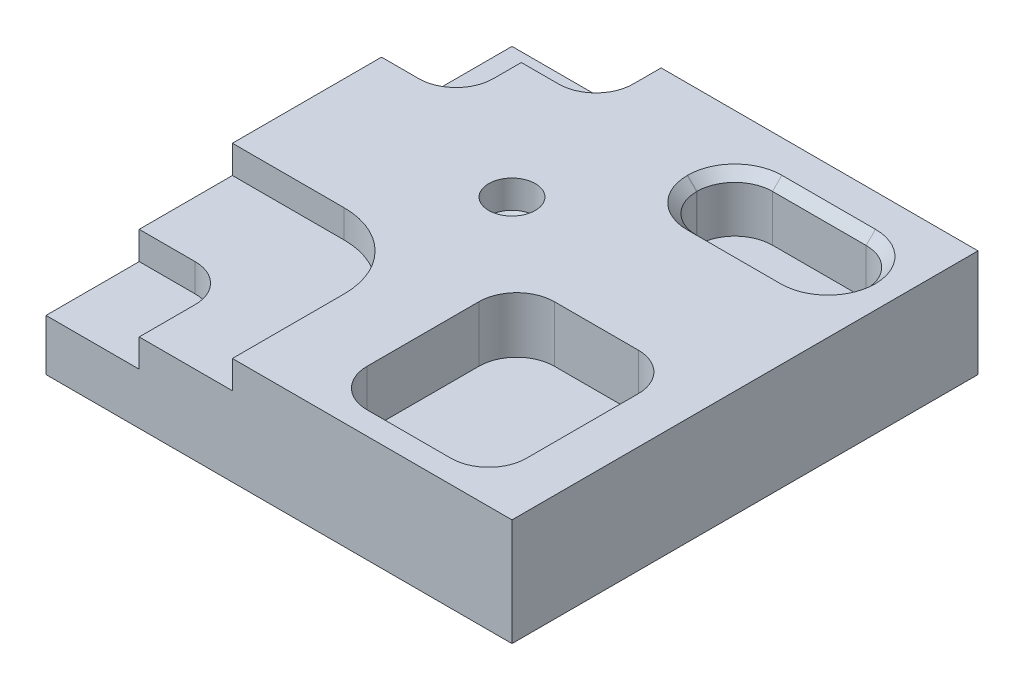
SolidWorks part; units mm, degrees
ref_plane "Front Plane" through (0, 0, 0) normal (0, 0, 1) x (1, 0, 0)
ref_plane "Top Plane" through (0, 0, 0) normal (0, 1, 0) x (1, 0, 0)
ref_plane "Right Plane" through (0, 0, 0) normal (1, 0, 0) x (0, 0, -1)
sketch "Sketch1" plane through (0, 0, 0) normal (0, 1, 0) x (1, 0, 0)
  line L1 (25, -25) -> (-25, -25)
  line L2 (25, -25) -> (25, 25)
  line L3 (25, 25) -> (-25, 25)
  line L4 (-25, -25) -> (-25, 25)
  line L5 (25, -25) -> (-25, 25) construction
  line L6 (25, 25) -> (-25, -25) construction
  point P0 (0, 0)
  dimension "D1" = 50
  dimension "D2" = 50
extrude "Boss-Extrude1" add sketch "Sketch1" along normal blind 11.5
sketch "Sketch2" plane through (0, 11.5, 0) normal (0, 1, 0) x (1, 0, 0)
  line L3 (-25, -15) -> (-15, -15)
  line L4 (-15, -25) -> (-15, -15)
  line L5 (-25, -25) -> (-5, -25)
  line L6 (-25, -25) -> (-25, -5)
  line L7 (-25, -5) -> (-5, -5)
  line L8 (-5, -25) -> (-5, -5)
  dimension "D1" = 10
  dimension "D2" = 10
  dimension "D3" = 20
  dimension "D4" = 20
extrude "Cut-Extrude1" cut sketch "Sketch2" against normal blind 6 contours L4 L3 M6 M5
sketch "Sketch3" plane through (0, 11.5, 0) normal (0, 1, 0) x (1, 0, 0)
  line L1 (-25, -25) -> (-5, -25)
  line L2 (-25, -25) -> (-25, -5)
  line L3 (-25, -5) -> (-5, -5)
  line L4 (-5, -25) -> (-5, -5)
  dimension "D1" = 20
  dimension "D2" = 20
extrude "Cut-Extrude2" cut sketch "Sketch3" against normal blind 3
fillet "Fillet1" radius 8 1 edges at (-5, 10, 5)
fillet "Fillet2" radius 4 1 edges at (-15, 7, 15)
sketch "Sketch4" plane through (0, 11.5, 0) normal (0, 1, 0) x (1, 0, 0)
  line L0 (-5, -25) -> (25, -25) construction
  line L1 (20.05, -22.55) -> (2.95, -22.55)
  line L2 (20.05, -22.55) -> (20.05, -2.45)
  line L3 (20.05, -2.45) -> (2.95, -2.45)
  line L4 (2.95, -22.55) -> (2.95, -2.45)
  line L5 (25, -25) -> (25, 25) construction
  dimension "D1" = 17.1
  dimension "D2" = 20.1
  dimension "D3" = 2.45
  dimension "D4" = 4.95
extrude "Cut-Extrude3" cut sketch "Sketch4" against normal blind 6
fillet "Fillet3" radius 4.05 4 edges at (2.95, 8.5, 22.55) (20.05, 8.5, 22.55) (20.05, 8.5, 2.45) (2.95, 8.5, 2.45)
sketch "Sketch5" plane through (0, 11.5, 0) normal (0, 1, 0) x (1, 0, 0)
  line L0 (-5, 25) -> (-5, -25) construction
  line L2 (25, 25) -> (-25, 25) construction
  line L4 (-25, 5) -> (25, 5) construction
  line L6 (-25, 25) -> (-25, -5) construction
  line L7 (25, -25) -> (25, 25) construction
  line L8 (-25, -25) -> (-15, -25) construction
  dimension "D1" = 30
  dimension "D2" = 20
sketch "Sketch6" plane through (0, 11.5, 0) normal (0, 1, 0) x (1, 0, 0)
  line L1 (-25, 25) -> (-9, 25)
  line L2 (-25, 25) -> (-25, 18)
  line L3 (-25, 18) -> (-9, 18)
  line L4 (-9, 25) -> (-9, 18)
  dimension "D1" = 7
  dimension "D2" = 16
extrude "Cut-Extrude4" cut sketch "Sketch6" against normal blind 6
sketch "Sketch7" plane through (0, 11.5, 0) normal (0, 1, 0) x (1, 0, 0)
  line L1 (-25, 18) -> (-17, 18)
  line L2 (-25, 18) -> (-25, 11)
  line L3 (-25, 11) -> (-17, 11)
  line L4 (-17, 18) -> (-17, 11)
  dimension "D1" = 7
  dimension "D2" = 8
extrude "Cut-Extrude5" cut sketch "Sketch7" against normal blind 6
fillet "Fillet4" radius 4 2 edges at (-9, 8.5, -18) (-17, 8.5, -11)
sketch "Sketch8" plane through (0, 11.5, 0) normal (0, 1, 0) x (1, 0, 0)
  line L0 (17.5, 25) -> (17.5, -25) construction
  line L4 (25, 25) -> (-9, 25) construction
  line L5 (-5, -25) -> (25, -25) construction
  line L6 (25, -25) -> (25, 25) construction
  line L7 (25, 20.5) -> (-25, 20.5) construction
  line L8 (-25, 25) -> (-25, 11) construction
  line L9 (25, 16.5) -> (-25, 16.5) construction
  dimension "D1" = 7.5
  dimension "D2" = 4.5
  dimension "D3" = 8.5
sketch "Sketch9" plane through (0, 11.5, 0) normal (0, 1, 0) x (1, 0, 0)
  line L0 (25, 20.5) -> (-25, 20.5) construction
  line L1 (21.55, 20.5) -> (3.4, 20.5)
  line L2 (21.55, 20.5) -> (21.55, 12.35)
  line L3 (21.55, 12.35) -> (3.4, 12.35)
  line L4 (3.4, 20.5) -> (3.4, 12.35)
  line L6 (25, -25) -> (25, 25) construction
  dimension "D1" = 18.15
  dimension "D2" = 8.15
  dimension "D3" = 3.45
extrude "Cut-Extrude6" cut sketch "Sketch9" against normal blind 6
fillet "Fillet5" radius 4.05 4 edges at (21.55, 8.5, -12.35) (3.4, 8.5, -12.35) (3.4, 8.5, -20.5) (21.55, 8.5, -20.5)
hole_wizard "#97 (0.11811024) Diameter Hole1" positions "Sketch10" profile "Sketch11" hole size "#97" standard "ANSI Inch"
sketch "Sketch10" plane through (0, 11.5, 0) normal (0, 1, 0) x (1, 0, 0)
  line L0 (-5, 25) -> (-5, -25) construction
  line L1 (-25, 5) -> (25, 5) construction
  point P0 (-5, 5)
sketch "Sketch11" plane through (-5, 11.5, -5) normal (1, 0, 0) x (0, 0, 1)
  line L0 (0, 0) -> (0, 6.9013)
  line L1 (0, 6.9013) -> (1.5, 6)
  line L2 (1.5, 6) -> (1.5, 0)
  line L5 (1.5, 0) -> (0, 0)
  line L10 (0, 6.9013) -> (-1.5, 6) construction
  line L11 (0, -6.35) -> (0, 107.95) construction
  dimension "Hole Dia." = 3
  dimension "Hole Depth" = 6
  dimension "Drill Angle" = 118
hole_wizard "#97 (0.19685039) Diameter Hole1" positions "3DSketch2" profile "Sketch13" hole size "#97" standard "ANSI Inch"
sketch3d "3DSketch2"
  line L0 (-5, 11.5, -25) -> (-5, 11.5, 25) construction
  line L1 (-25, 11.5, -5) -> (25, 11.5, -5) construction
  point P0 (-5, 11.5, -5)
sketch "Sketch13" plane through (-5, 11.5, -5) normal (1, 0, 0) x (0, 0, 1)
  line L0 (0, 0) -> (0, 4.5022)
  line L1 (0, 4.5022) -> (2.5, 3)
  line L2 (2.5, 3) -> (2.5, 0)
  line L5 (2.5, 0) -> (0, 0)
  line L10 (0, 4.5022) -> (-2.5, 3) construction
  line L11 (0, -6.35) -> (0, 107.95) construction
  dimension "Hole Dia." = 5
  dimension "Hole Depth" = 3
  dimension "Drill Angle" = 118
sketch "Sketch14" plane through (0, 11.5, 0) normal (0, 1, 0) x (1, 0, 0)
  text T0 "z5259927"
chamfer "Chamfer1" distance 1 angle 45 8 edges at (20.3638, 11.5, -19.3138) (12.475, 11.5, -20.5) (4.5862, 11.5, -19.3138) (21.55, 11.5, -16.425) (3.4, 11.5, -16.425) (20.3638, 11.5, -13.5362) (4.5862, 11.5, -13.5362) (12.475, 11.5, -12.35)
